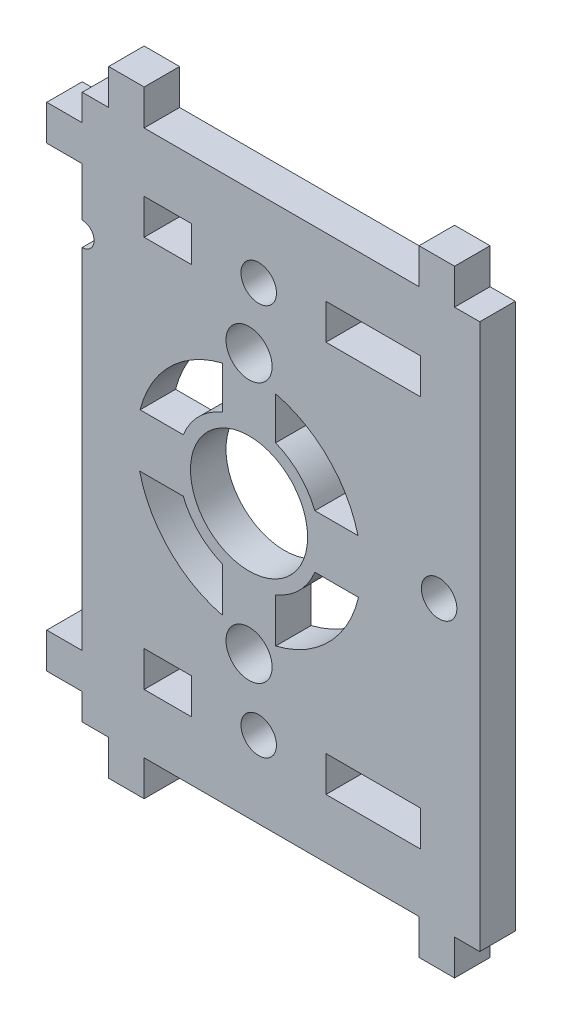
SolidWorks part; units mm, degrees
ref_plane "Front Plane" through (0, 0, 0) normal (0, 0, 1) x (1, 0, 0)
ref_plane "Top Plane" through (0, 0, 0) normal (0, 1, 0) x (1, 0, 0)
ref_plane "Right Plane" through (0, 0, 0) normal (1, 0, 0) x (0, 0, -1)
sketch "Sketch1" plane through (0, 0, 0) normal (0, 0, 1) x (1, 0, 0)
  line L41 (10.4525, 159.9411) -> (13.4525, 159.9411)
  line L43 (24.5706, 195.1404) -> (24.5706, 191.5533)
  line L44 (24.5706, 180.429) -> (24.5706, 176.681)
  line L45 (20.0706, 195.1404) -> (20.0706, 191.5533)
  line L46 (20.0706, 180.429) -> (20.0706, 176.681)
  line L47 (13.0716, 183.7411) -> (16.7584, 183.7411)
  line L48 (27.8827, 183.7411) -> (31.5695, 183.7411)
  line L49 (13.1108, 188.2411) -> (16.7584, 188.2411)
  line L50 (27.8827, 188.2411) -> (31.5303, 188.2411)
  line L51 (10.4525, 212.0411) -> (13.4525, 212.0411)
  line L56 (13.4525, 209.0411) -> (13.4525, 212.0411)
  line L57 (10.4525, 209.0411) -> (10.4525, 212.0411)
  line L58 (8.2206, 209.0411) -> (10.4525, 209.0411)
  line L60 (13.4525, 209.0411) -> (36.6887, 209.0411)
  line L61 (39.6887, 209.0411) -> (41.8206, 209.0411)
  line L62 (13.4525, 204.0411) -> (17.4525, 204.0411)
  line L63 (28.8206, 204.0411) -> (36.8206, 204.0411)
  line L64 (13.4525, 201.0411) -> (17.4525, 201.0411)
  line L65 (28.8206, 201.0411) -> (36.8206, 201.0411)
  line L66 (10.4525, 159.9411) -> (13.4525, 159.9411)
  line L70 (13.4525, 162.9411) -> (13.4525, 159.9411)
  line L71 (10.4525, 162.9411) -> (10.4525, 159.9411)
  line L72 (8.2206, 162.9411) -> (10.4525, 162.9411)
  line L74 (13.4525, 162.9411) -> (36.6887, 162.9411)
  line L75 (39.6887, 162.9411) -> (41.8206, 162.9411)
  line L76 (41.8206, 209.0411) -> (41.8206, 162.9411)
  line L81 (36.8206, 204.0411) -> (36.8206, 201.0411)
  line L82 (28.8206, 204.0411) -> (28.8206, 201.0411)
  line L83 (17.4525, 204.0411) -> (17.4525, 201.0411)
  line L84 (13.4525, 204.0411) -> (13.4525, 201.0411)
  line L85 (13.4525, 167.9411) -> (17.4525, 167.9411)
  line L86 (28.8206, 167.9411) -> (36.8206, 167.9411)
  line L87 (13.4525, 170.9411) -> (17.4525, 170.9411)
  line L88 (28.8206, 170.9411) -> (36.8206, 170.9411)
  line L89 (36.8206, 167.9411) -> (36.8206, 170.9411)
  line L90 (28.8206, 167.9411) -> (28.8206, 170.9411)
  line L91 (17.4525, 167.9411) -> (17.4525, 170.9411)
  line L92 (13.4525, 167.9411) -> (13.4525, 170.9411)
  line L115 (41.8206, 209.0411) -> (39.6887, 209.0411)
  line L116 (41.8206, 162.9411) -> (39.6887, 162.9411)
  line L117 (36.6887, 212.0411) -> (39.6887, 212.0411)
  line L118 (39.6887, 212.0411) -> (39.6887, 209.0411)
  line L119 (36.6887, 212.0411) -> (36.6887, 209.0411)
  line L120 (36.6887, 159.9411) -> (39.6887, 159.9411)
  line L121 (39.6887, 159.9411) -> (39.6887, 162.9411)
  line L122 (36.6887, 159.9411) -> (36.6887, 162.9411)
  line L1036 (8.2206, 162.9411) -> (8.2206, 165.173)
  line L1037 (8.2206, 168.173) -> (8.2206, 197.677)
  line L1038 (8.2206, 206.8092) -> (8.2206, 209.0411)
  line L1039 (5.2206, 203.8092) -> (5.2206, 206.8092)
  line L1040 (8.2206, 206.8092) -> (5.2206, 206.8092)
  line L1041 (8.2206, 203.8092) -> (5.2206, 203.8092)
  line L1042 (5.2206, 168.173) -> (5.2206, 165.173)
  line L1043 (8.2206, 165.173) -> (5.2206, 165.173)
  line L1044 (8.2206, 168.173) -> (5.2206, 168.173)
  line L1045 (8.2206, 199.677) -> (8.2206, 203.8092)
  circle A23 centre (22.3206, 174.9911) radius 1.95
  circle A24 centre (22.3206, 196.9911) radius 1.95
  circle A25 centre (22.3206, 185.9911) radius 4.95
  arc A26 (20.0706, 191.5533) -> (16.7584, 188.2411) centre (22.3206, 185.9911) ccw
  arc A27 (16.7584, 183.7411) -> (20.0706, 180.429) centre (22.3206, 185.9911) ccw
  arc A28 (24.5706, 180.429) -> (27.8827, 183.7411) centre (22.3206, 185.9911) ccw
  arc A29 (27.8827, 188.2411) -> (24.5706, 191.5533) centre (22.3206, 185.9911) ccw
  arc A30 (20.0706, 195.1404) -> (13.1108, 188.2411) centre (22.3206, 185.9107) ccw
  arc A31 (13.0716, 183.7411) -> (20.0706, 176.681) centre (22.3206, 185.9107) ccw
  arc A32 (24.5706, 176.681) -> (31.5695, 183.7411) centre (22.3206, 185.9107) ccw
  arc A33 (31.5303, 188.2411) -> (24.5706, 195.1404) centre (22.3206, 185.9107) ccw
  circle A34 centre (23.1365, 202.5411) radius 1.5
  circle A36 centre (23.1365, 169.4411) radius 1.5
  arc A312 (8.2206, 197.677) -> (8.2206, 199.677) centre (8.2206, 198.677) ccw
  circle A341 centre (38.3843, 187.0711) radius 1.5
extrude "Boss-Extrude1" add sketch "Sketch1" along normal blind 3 contours A312 L1037 L1044 L1042 L1043 L1036 L72 L71 L41 L70 L74 L122 L120 L121 L75 L76 L61 L118 L117 L119 L60 L56 L51 L57 L58 L1038 L1040 L1039 L1041 L1045 A341 A36 A34 A33 L50 A29 L43 A32 L44 A28 L48 A31 L47 A27 L46
